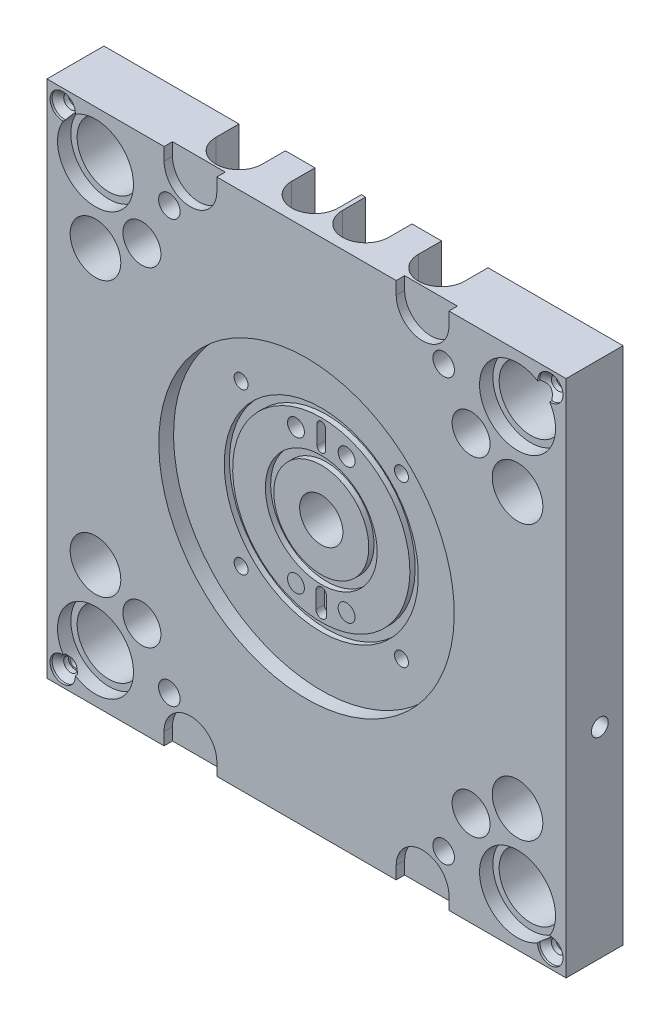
SolidWorks part; units mm, degrees
other "Objet de détail1"
ref_plane "Plan de face" through (0, 0, 0) normal (0, 0, 1) x (1, 0, 0)
ref_plane "Plan de dessus" through (0, 0, 0) normal (0, 1, 0) x (1, 0, 0)
ref_plane "Plan de droite" through (0, 0, 0) normal (1, 0, 0) x (0, 0, -1)
sketch "Esquisse1" plane through (0, 0, 0) normal (0, 0, 1) x (1, 0, 0)
  line L1 (-123, 123) -> (123, 123)
  line L2 (-123, 123) -> (-123, -123)
  line L3 (-123, -123) -> (123, -123)
  line L4 (123, 123) -> (123, -123)
  dimension "D1" = 246
  dimension "D2" = 246
  dimension "D3" = 123
  dimension "D4" = 123
extrude "ExtrusionPlaque" add sketch "Esquisse1" along normal blind 27
sketch "Esquisse2" plane through (0, 0, 0) normal (1, 0, 0) x (0, 0, -1)
  line L0 (2.3658, 0) -> (-28.3416, 0) construction
  line L1 (0, 10.25) -> (-20, 10.25)
  line L2 (0, -123) -> (0, 123) construction
  line L3 (-20, 10.25) -> (-20, 22.5)
  line L4 (-20, 22.5) -> (-17.5, 22.5)
  line L5 (-17.5, 22.5) -> (-17.5, 26.5)
  line L6 (-17.5, 26.5) -> (-20, 26.5)
  line L7 (-20, 26.5) -> (-20, 42)
  line L8 (-20, 42) -> (-17.5, 42)
  line L9 (-17.5, 42) -> (-17.5, 46)
  line L10 (-17.5, 46) -> (-20, 46)
  line L11 (-20, 46) -> (-20, 70)
  line L12 (-20, 70) -> (-27, 70)
  line L13 (-27, -123) -> (-27, 123) construction
  line L14 (-27, 70) -> (-27, 0)
  line L15 (0, 0) -> (-27, 0)
  line L16 (0, 0) -> (0, 10.25)
  dimension "D1" = 20.5
  dimension "D2" = 7
  dimension "D3" = 2.5
  dimension "D4" = 45
  dimension "D5" = 53
  dimension "D6" = 140
  dimension "D7" = 92
  dimension "D8" = 84
revolve "LogementBlocEtJoints" cut sketch "Esquisse2" angle 360 about L0
hole_wizard "ChambrageDouille" positions "Esquisse4" profile "Esquisse3" counterbore size "24" standard "HASCO Metric"
sketch "Esquisse4" plane through (0, 0, 27) normal (0, 0, 1) x (1, 0, 0)
  point P0 (-100, 100)
sketch "Esquisse3" plane through (-100, 100, 27) normal (1, 0, 0) x (0, -1, 0)
  line L0 (0, 0) -> (0, 27)
  line L1 (0, 27) -> (15, 27)
  line L3 (15, 27) -> (15, 6.3)
  line L4 (15, 6.3) -> (18, 6.3)
  line L5 (18, 6.3) -> (18, 0)
  line L7 (18, 0) -> (0, 0)
  line L11 (0, -6.35) -> (0, 107.95) construction
  dimension "Diamètre du perçage jusqu'au prochain" = 30
  dimension "Profondeur du perçage jusqu'au prochain" = 27
  dimension "Diamètre du chambrage" = 36
  dimension "Profondeur du chambrage" = 6.3
pattern_linear "RépétitionChamDouille" count 2 spacing 200 along (1, 0, 0) count 2 spacing 200 along (0, -1, 0) of "ChambrageDouille"
hole_wizard "Chambrage pour Vis épaulée 16 mm1" positions "Esquisse6" profile "Esquisse5" counterbore size "16" standard "HASCO Metric"
sketch "Esquisse6" plane through (0, 0, 27) normal (0, 0, 1) x (1, 0, 0)
  point P0 (-100, 65)
sketch "Esquisse5" plane through (-100, 65, 27) normal (1, 0, 0) x (0, -1, 0)
  line L0 (0, 0) -> (0, 27)
  line L1 (0, 27) -> (8.5, 27)
  line L3 (8.5, 27) -> (8.5, 17)
  line L4 (8.5, 17) -> (12, 17)
  line L5 (12, 17) -> (12, 0)
  line L7 (12, 0) -> (0, 0)
  line L11 (0, -6.35) -> (0, 107.95) construction
  dimension "Diamètre du perçage jusqu'au prochain" = 17
  dimension "Profondeur du perçage jusqu'au prochain" = 27
  dimension "Diamètre du chambrage" = 24
  dimension "Profondeur du chambrage" = 17
pattern_linear "RépétitionChambrage" count 2 spacing 200 along (1, 0, 0) count 2 spacing 130 along (0, -1, 0) of "Chambrage pour Vis épaulée 16 mm1"
hole_wizard "Fraisage pour vis à tête fraisée M101" positions "Esquisse8" profile "Esquisse7" countersink size "M10" standard "HASCO Metric"
sketch "Esquisse8" plane through (0, 0, 27) normal (0, 0, 1) x (1, 0, 0)
  point P0 (-115.555, 115.555)
sketch "Esquisse7" plane through (-115.555, 115.555, 27) normal (1, 0, 0) x (0, -1, 0)
  line L0 (0, 0) -> (0, 6)
  line L1 (0, 6) -> (3.25, 6)
  line L2 (3.25, 6) -> (3.25, 3.75)
  line L3 (3.25, 3.75) -> (6, 1)
  line L4 (6, 1) -> (6, 0)
  line L6 (6, 0) -> (0, 0)
  line L7 (-3.25, 3.75) -> (-6, 1) construction
  line L10 (0, 6) -> (-3.25, 6) construction
  line L11 (0, -6.35) -> (0, 107.95) construction
  dimension "Diamètre du perçage" = 6.5
  dimension "Profondeur du perçage" = 6
  dimension "Diamètre du fraisage" = 12
  dimension "Angle du fraisage" = 90
  dimension "Angle de pointe" = 180
  dimension "Dégagement de la tête" = 1
hole_wizard "Trou taraudé M6x1.01" positions "Esquisse10" profile "Esquisse9" tap size "M6x1.0" standard "HASCO Metric"
sketch "Esquisse10" plane through (0, 0, 21) normal (0, 0, 1) x (1, 0, 0)
  point P0 (-115.555, 115.555)
sketch "Esquisse9" plane through (-115.555, 115.555, 21) normal (1, 0, 0) x (0, -1, 0)
  line L0 (0, 0) -> (0, 22.4434)
  line L1 (0, 22.4434) -> (2.5, 21)
  line L2 (2.5, 21) -> (2.5, 0)
  line L5 (2.5, 0) -> (0, 0)
  line L10 (0, 22.4434) -> (-2.5, 21) construction
  line L11 (0, -6.35) -> (0, 107.95) construction
  dimension "Diamètre du trou pour taraudage" = 5
  dimension "Profondeur du trou pour taraudage" = 21
  dimension "Angle de pointe" = 120
pattern_linear "RépétitionTrouTaraudFraisure" count 2 spacing 231.11 along (1, 0, 0) count 2 spacing 231.11 along (0, -1, 0) of "Fraisage pour vis à tête fraisée M101", "Trou taraudé M6x1.01"
hole_wizard "DégagementTirant" positions "Esquisse12" profile "Esquisse11" hole size "M16" standard "ISO"
sketch "Esquisse12" plane through (0, 0, 27) normal (0, 0, 1) x (1, 0, 0)
  point P0 (-78, 78)
sketch "Esquisse11" plane through (-78, 78, 27) normal (1, 0, 0) x (0, -1, 0)
  line L0 (0, 0) -> (0, 27)
  line L1 (0, 27) -> (9, 27)
  line L2 (9, 27) -> (9, 0)
  line L5 (9, 0) -> (0, 0)
  line L11 (0, -6.35) -> (0, 107.95) construction
  dimension "Diamètre du perçage jusqu'au prochain" = 18
  dimension "Profondeur du perçage jusqu'au prochain" = 27
pattern_linear "RépétitionDégTirant" count 2 spacing 156 along (1, 0, 0) count 2 spacing 156 along (0, -1, 0) of "DégagementTirant"
hole_wizard "TaraudageTirant" positions "Esquisse14" profile "Esquisse13" tap size "M12x1.75" standard "HASCO Metric"
sketch "Esquisse14" plane through (0, 0, 27) normal (0, 0, 1) x (1, 0, 0)
  point P0 (-65, 100)
sketch "Esquisse13" plane through (-65, 100, 27) normal (1, 0, 0) x (0, -1, 0)
  line L0 (0, 0) -> (0, 27.9445)
  line L1 (0, 27.9445) -> (5.1, 25)
  line L2 (5.1, 25) -> (5.1, 0)
  line L5 (5.1, 0) -> (0, 0)
  line L10 (0, 27.9445) -> (-5.1, 25) construction
  line L11 (0, -6.35) -> (0, 107.95) construction
  dimension "Diamètre du trou pour taraudage" = 10.2
  dimension "Profondeur du trou pour taraudage" = 25
  dimension "Angle de pointe" = 120
pattern_linear "RépétitionTaraudTirant" count 2 spacing 130 along (1, 0, 0) count 2 spacing 200 along (0, -1, 0) of "TaraudageTirant"
sketch "Esquisse15" plane through (0, 0, 27) normal (0, 0, 1) x (1, 0, 0)
  line L0 (-42.5, 117) -> (-42.5, 123)
  line L1 (123, 123) -> (-123, 123) construction
  line L2 (-42.5, 123) -> (-67.5, 123)
  line L3 (-67.5, 123) -> (-67.5, 117)
  arc A0 (-67.5, 117) -> (-42.5, 117) centre (-55, 117) ccw
extrude "EncocheDécollementPlaques" cut sketch "Esquisse15" against normal blind 4
pattern_linear "RépétitionEncoche" count 2 spacing 110 along (1, 0, 0) of "EncocheDécollementPlaques"
mirror "SymétrieEncoches" about plane through (0, 0, 0) normal (0, 1, 0) of "RépétitionEncoche", "EncocheDécollementPlaques"
hole_wizard "Perçage8Régul" positions "Esquisse17" profile "Esquisse16" hole size "8" standard "HASCO Metric"
sketch "Esquisse17" plane through (0, 0, 20) normal (0, 0, 1) x (1, 0, 0)
  point P0 (-12, 32)
sketch "Esquisse16" plane through (-12, 32, 20) normal (1, 0, 0) x (0, -1, 0)
  line L0 (0, 0) -> (0, 13)
  line L1 (0, 13) -> (4, 13)
  line L2 (4, 13) -> (4, 0)
  line L5 (4, 0) -> (0, 0)
  line L10 (0, 13) -> (-4, 13) construction
  line L11 (0, -6.35) -> (0, 107.95) construction
  dimension "Diamètre du perçage" = 8
  dimension "Profondeur du perçage" = 13
  dimension "Angle de pointe" = 180
pattern_linear "RépétitionPerçRégul" count 2 spacing 24 along (1, 0, 0) of "Perçage8Régul"
sketch "Esquisse18" plane through (0, 0, 20) normal (0, 0, 1) x (1, 0, 0)
  line L2 (2, 38.5) -> (2, 29.5)
  line L4 (-2, 38.5) -> (-2, 29.5)
  arc A0 (2, 38.5) -> (-2, 38.5) centre (0, 38.5) ccw
  arc A1 (-2, 29.5) -> (2, 29.5) centre (0, 29.5) ccw
  dimension "D3" = 29.5
  dimension "D1" = 9
  dimension "D2" = 4
  dimension "D4" = 2
extrude "LogementBochonSéparation" cut sketch "Esquisse18" against normal blind 4
hole_wizard "ChambrageVisFixationBloc" positions "Esquisse20" profile "Esquisse19" counterbore size "M6" standard "HASCO Metric"
sketch "Esquisse20" plane through (0, 0, 0) normal (0, 0, -1) x (-1, 0, 0)
  point P0 (38, 38)
sketch "Esquisse19" plane through (-38, 38, 0) normal (1, 0, 0) x (0, 1, 0)
  line L0 (0, 0) -> (0, 27)
  line L1 (0, 27) -> (3.3, 27)
  line L3 (3.3, 27) -> (3.3, 6)
  line L4 (3.3, 6) -> (5.5, 6)
  line L5 (5.5, 6) -> (5.5, 0)
  line L7 (5.5, 0) -> (0, 0)
  line L11 (0, -6.35) -> (0, 107.95) construction
  dimension "Diamètre du perçage jusqu'au prochain" = 6.6
  dimension "Profondeur du perçage jusqu'au prochain" = 27
  dimension "Diamètre du chambrage" = 11
  dimension "Profondeur du chambrage" = 6
pattern_linear "RépétitionChamVisBloc" count 2 spacing 76 along (1, 0, 0) count 2 spacing 76 along (0, -1, 0) of "ChambrageVisFixationBloc"
sketch "Esquisse21" plane through (0, 123, 0) normal (0, 1, 0) x (-1, 0, 0)
  line L0 (-123, 0) -> (123, 0) construction
  line L1 (1, 11) -> (1, 0)
  line L2 (1, 0) -> (23, 0)
  line L3 (23, 0) -> (23, 11)
  arc A0 (23, 11) -> (1, 11) centre (12, 11) ccw
  dimension "D3" = 22
  dimension "D1" = 11
  dimension "D2" = 12
extrude "LamageRaccords" cut sketch "Esquisse21" against normal blind 23
hole_wizard "TaraudageRaccordsCircuitRégul" positions "2" profile "3" counterbore size "8" standard "HASCO Metric"
sketch "2" plane through (0, 100, 0) normal (0, 1, 0) x (-1, 0, 0)
  point P0 (12, 11)
sketch "3" plane through (-12, 100, 11) normal (1, 0, 0) x (0, 0, 1)
  line L0 (0, 0) -> (0, 124)
  line L1 (0, 124) -> (4, 124)
  line L3 (4, 124) -> (4, 13)
  line L4 (4, 13) -> (5.75, 13)
  line L5 (5.75, 13) -> (5.75, 0)
  line L7 (5.75, 0) -> (0, 0)
  line L11 (0, -6.35) -> (0, 107.95) construction
  dimension "Diamètre du perçage jusqu'au prochain" = 8
  dimension "Profondeur du perçage jusqu'au prochain" = 124
  dimension "Diamètre du chambrage" = 11.5
  dimension "Profondeur du chambrage" = 13
mirror "SymétrieTarRaccordCircuitRégul" about plane through (0, 0, 0) normal (1, 0, 0) of "TaraudageRaccordsCircuitRégul", "LamageRaccords"
hole_wizard "SOL1_PerçageRégul" positions "Esquisse25" profile "Esquisse24" hole size "M8" standard "ISO"
sketch "Esquisse25" plane through (123, 0, 0) normal (1, 0, 0) x (0, 0, -1)
  line L0 (0, -123) -> (0, 123) construction
  point P0 (-11, -28)
  point P9 (0, 0)
  dimension "D1" = 28
sketch "Esquisse24" plane through (123, -28, 11) normal (0, 1, 0) x (0, 0, -1)
  line L0 (0, 0) -> (0, 177.4034)
  line L1 (0, 177.4034) -> (4, 175)
  line L2 (4, 175) -> (4, 0)
  line L5 (4, 0) -> (0, 0)
  line L10 (0, 177.4034) -> (-4, 175) construction
  line L11 (0, -6.35) -> (0, 107.95) construction
  dimension "Diamètre du perçage" = 8
  dimension "Profondeur du perçage" = 175
  dimension "Angle de pointe" = 118
sketch "1" plane through (-38.0763, 123, -1.191) normal (0, 1, 0) x (-1, 0, 0)
  line L1 (-1.0763, 12.191) -> (-1.0763, 0.691)
  line L2 (-1.0763, 0.691) -> (20.9237, 0.691)
  line L3 (20.9237, 0.691) -> (20.9237, 12.191)
  line L4 (-15.0763, 1.191) -> (84.9237, 1.191) construction
  arc A0 (20.9237, 12.191) -> (-1.0763, 12.191) centre (9.9237, 12.191) ccw
  dimension "D3" = 22
  dimension "D1" = 48
  dimension "D2" = 11
extrude "SOL1_LamageRaccord" cut sketch "1" against normal blind 23
hole_wizard "SOL1_TaraudageRaccordCircuitRégul" positions "2" profile "3" counterbore size "8" standard "HASCO Metric"
sketch "2" plane through (-38.0763, 100, -1.191) normal (0, 1, 0) x (-1, 0, 0)
  arc A0 (20.9237, 12.191) -> (-1.0763, 12.191) centre (9.9237, 12.191) ccw construction
  point P0 (9.9237, 12.191)
sketch "3" plane through (-48, 100, 11) normal (1, 0, 0) x (0, 0, 1)
  line L0 (0, 0) -> (0, 223)
  line L1 (0, 223) -> (4, 223)
  line L3 (4, 223) -> (4, 13)
  line L4 (4, 13) -> (5.75, 13)
  line L5 (5.75, 13) -> (5.75, 0)
  line L7 (5.75, 0) -> (0, 0)
  line L11 (0, -6.35) -> (0, 107.95) construction
  dimension "Diamètre du perçage jusqu'au prochain" = 8
  dimension "Profondeur du perçage jusqu'au prochain" = 223
  dimension "Diamètre du chambrage" = 11.5
  dimension "Profondeur du chambrage" = 13
mirror "SOL1_SymLamTarRaccCircRégul" about plane through (0, 0, 0) normal (1, 0, 0) of "SOL1_LamageRaccord", "SOL1_TaraudageRaccordCircuitRégul"
mirror "SOL1_SymPerç8RégulEtLogemBouchon" about plane through (0, 0, 0) normal (0, 1, 0) of "RépétitionPerçRégul", "Perçage8Régul"
sketch "Esquisse27" plane through (0, 0, 20) normal (0, 0, 1) x (1, 0, 0)
  line L2 (2.5, -38) -> (2.5, -30)
  line L4 (-2.5, -38) -> (-2.5, -30)
  arc A0 (2.5, -30) -> (-2.5, -30) centre (0, -30) ccw
  arc A1 (-2.5, -38) -> (2.5, -38) centre (0, -38) ccw
  dimension "D1" = 2.5
  dimension "D2" = 2.5
  dimension "D3" = 8
  dimension "D4" = 30
  dimension "D5" = 2.5
  dimension "D6" = 5
extrude "SOL1_RainureDétrompage" cut sketch "Esquisse27" against normal blind 4
mirror "SOL2_SymRégulExistante" [suppressed] about plane through (0, 0, 0) normal (0, 1, 0)
sketch "Esquisse26" [suppressed] plane through (0, 0, 16) normal (0, 0, 1) x (1, 0, 0)
  line L4 (2.5, -38.5) -> (2.5, -29.5)
  line L5 (-2.5, -29.5) -> (-2.5, -38.5)
  line L6 (2.5, -38.5) -> (2.5, -29.5)
  line L7 (-2.5, -29.5) -> (-2.5, -38.5)
  arc A4 (-2.5, -38.5) -> (2.5, -38.5) centre (0, -38.5) ccw
  arc A5 (2.5, -29.5) -> (-2.5, -29.5) centre (0, -29.5) ccw
  arc A6 (-2.5, -38.5) -> (2.5, -38.5) centre (0, -38.5) ccw
  arc A7 (2.5, -29.5) -> (-2.5, -29.5) centre (0, -29.5) ccw
  dimension "D1" = 0.5
extrude "SOL2_RainureDétrompage" [suppressed] cut sketch "Esquisse26" along normal through all
